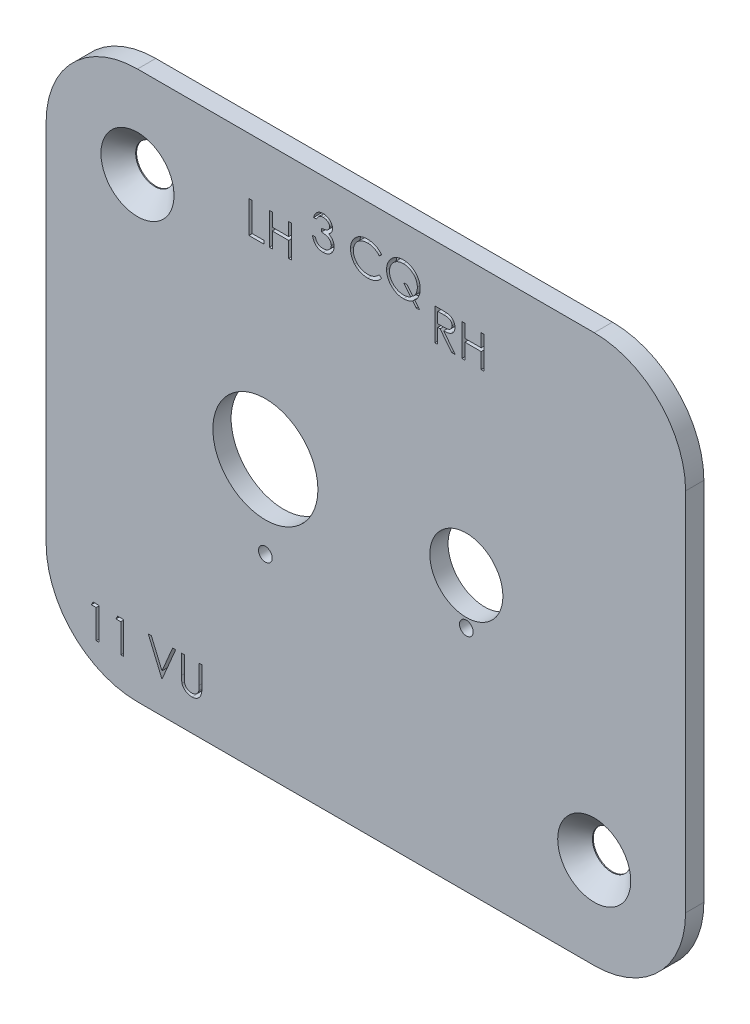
SolidWorks part; units mm, degrees
ref_plane "Plan de face" through (0, 0, 0) normal (0, 0, 1) x (1, 0, 0)
ref_plane "Plan de dessus" through (0, 0, 0) normal (0, 1, 0) x (1, 0, 0)
ref_plane "Plan de droite" through (0, 0, 0) normal (1, 0, 0) x (0, 0, -1)
sketch "Esquisse1" plane through (0, 0, 0) normal (0, 0, 1) x (1, 0, 0)
  line L1 (0, 0) -> (70, 0)
  line L2 (0, 0) -> (0, 60)
  line L3 (0, 60) -> (70, 60)
  line L4 (70, 0) -> (70, 60)
  dimension "D1" = 70
  dimension "D2" = 60
extrude "Boss.-Extru.1" add sketch "Esquisse1" against normal blind 2
fillet "Congé1" radius 10 4 edges at (70, 0, -1) (0, 0, -1) (0, 60, -1) (70, 60, -1)
sketch "Esquisse2" plane through (0, 0, 0) normal (0, 0, 1) x (1, 0, 0)
  line L0 (-9.6552, 50) -> (75.5928, 50) construction
  line L1 (-10.7481, 10) -> (82.5602, 10) construction
  line L2 (10, 73.7307) -> (10, -2.5007) construction
  line L3 (60, 73.7307) -> (60, -3.457) construction
  line L4 (60, 60) -> (10, 60) construction
  line L5 (0, 50) -> (0, 10) construction
  line L6 (10, 0) -> (60, 0) construction
  line L7 (70, 10) -> (70, 50) construction
  circle A0 centre (10, 50) radius 2.1
  circle A1 centre (60, 10) radius 2.1
  point P10 (0, 30)
  dimension "D5" = 4.2
  dimension "D6" = 4.2
  dimension "D1" = 10
  dimension "D2" = 10
  dimension "D3" = 10
  dimension "D4" = 10
extrude "Enlèv. mat.-Extru.1" cut sketch "Esquisse2" against normal through all
chamfer "Chanfrein1" distance 1.9 angle 45 2 edges at (62.1, 10, 0) (12.1, 50, 0)
sketch "Esquisse4" plane through (0, 0, 0) normal (0, 0, 1) x (1, 0, 0)
  text T0 "LH"
  text T1 "RH  "
  text T2 "3 CQ  "
  text T3 "11 VU"
extrude "Enlèv. mat.-Extru.4" cut sketch "Esquisse4" against normal blind 1
sketch "Esquisse5" plane through (0, 0, 0) normal (0, 0, 1) x (1, 0, 0)
  line L1 (0, 50) -> (0, 10) construction
  line L2 (70, 10) -> (70, 50) construction
  line L3 (10, 0) -> (60, 0) construction
  circle A0 centre (24, 30) radius 5.75
  circle A1 centre (46, 30) radius 4
  circle A2 centre (46, 25) radius 0.75
  circle A3 centre (24, 21) radius 0.75
  dimension "D1" = 11.5
  dimension "D2" = 8
  dimension "D7" = 5
  dimension "D8" = 1.5
  dimension "D10" = 1.5
  dimension "D3" = 24
  dimension "D4" = 24
  dimension "D5" = 30
  dimension "D6" = 30
  dimension "D9" = 24
  dimension "D11" = 9
  dimension "D12" = 24
extrude "Enlèv. mat.-Extru.5" cut sketch "Esquisse5" against normal through all
